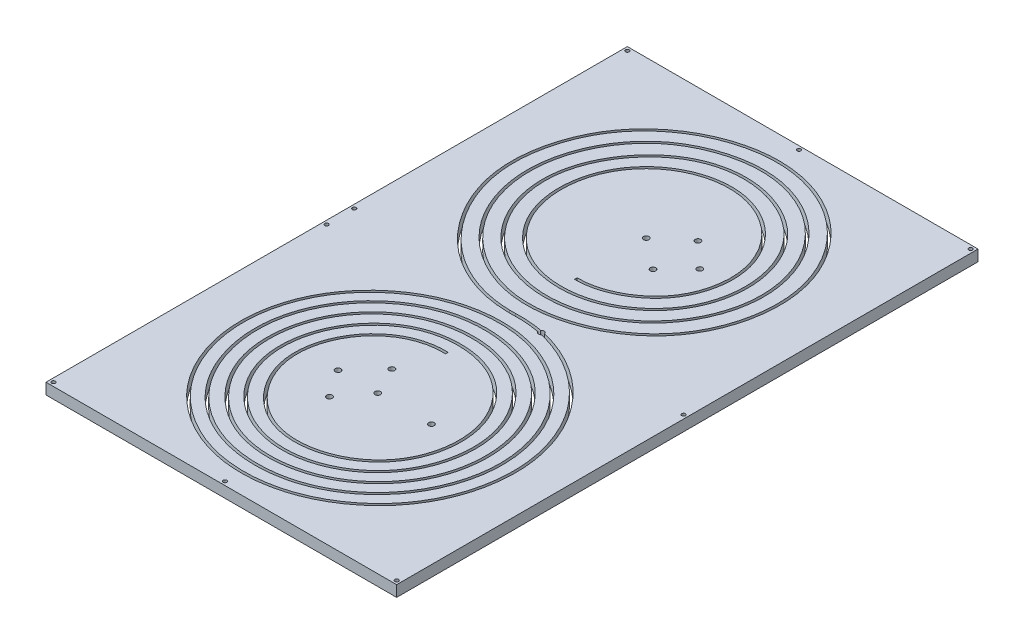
SolidWorks part; units mm, degrees
other "DetailItem1"
other "DetailItem4"
other "DetailItem5"
other "DetailItem6"
other "DetailItem7"
other "DetailItem8"
other "DetailItem9" parameters "D1"=130.8525, "D2"=69.4319, "D3"=36.4963, "D6"=12.8171, "D7"=5.2372, "D10"=14.4827, "D11"=5.361, "D14"=24.1385, "D15"=20.5722, "D17"=38.5709, "D19"=45.3058, "D22"=29.037, "D23"=48.8293, "D26"=23.3871, "D27"=9.5443, "D30"=7.2661, "D31"=33.8625, "D34"=24.3242, "D35"=7.7399, "D37"=19.4478, "D40"=16.1936, "D41"=5.7291, "D45"=13.6758, "D46"=22.4702, "D47"=36.4682, "D49"=70.9831, "D51"=12.9944, "D52"=19.8798, "D53"=33.549, "D55"=14.6272, "D58"=25.9, "D59"=4.812, "D61"=19.4793, "D66"=10.7086, "D67"=23.8166, "b3"=32, "b1"=223, "b2"=64, "D4"=32, "D5"=2.4589, "D8"=7.2455, "D9"=8.6909, "D12"=8.8045, "D13"=3.012, "D16"=2.6913, "D18"=4.7672, "D20"=1.0261, "D21"=1.3223, "D24"=8.5232, "D25"=4.2331, "D28"=9.8065, "D29"=3.1398, "D32"=14.9275, "D33"=6.4131, "D36"=5.6369, "D38"=5.0915, "D39"=2.1678, "D42"=6.9245, "D43"=3.6449, "D44"=2.0168, "D48"=2.1215, "D50"=2.0134, "D54"=10.9796, "D56"=6.0024, "D57"=3.0599, "D60"=4.877, "D62"=6.7641, "D63"=2.9135, "D64"=4.0127, "D65"=2.5645
other "DetailItem10"
other "DetailItem11"
other "DetailItem12"
other "DetailItem13"
other "DetailItem14"
other "DetailItem15"
other "DetailItem16"
other "DetailItem17"
other "DetailItem18"
other "DetailItem19"
other "DetailItem20"
other "DetailItem21"
other "DetailItem22"
other "DetailItem29"
other "DetailItem30"
other "DetailItem31"
other "DetailItem32"
other "DetailItem33"
other "DetailItem34"
ref_plane "Front Plane" through (0, 0, 0) normal (0, 0, 1) x (1, 0, 0)
ref_plane "Top Plane" through (0, 0, 0) normal (0, 1, 0) x (1, 0, 0)
ref_plane "Right Plane" through (0, 0, 0) normal (1, 0, 0) x (0, 0, -1)
sketch "Sketch1" plane through (-5.7981, 0, 1.7854) normal (0, -1, 0) x (-1, 0, 0)
  line L2 (-5.7981, 1.7854) -> (-5.7981, -70.9646) construction
  line L36 (-5.7981, 74.5354) -> (-5.7981, 1.7854) construction
  circle A0 centre (-5.7981, 1.7854) radius 55.4556
  circle A1 centre (-5.7981, 1.7854) radius 15.9155
  circle A2 centre (-5.7981, 1.7854) radius 7.9577
  circle A3 centre (17.721, 11.2854) radius 9.4498
  circle A4 centre (17.721, 11.2854) radius 11.9366
  circle A5 centre (8.8683, 26.8487) radius 5.9683
  circle A6 centre (8.8683, 26.8487) radius 31.5823
  circle A7 centre (-21.7136, 1.7854) radius 7.9577
  circle A8 centre (-21.7136, 1.7854) radius 7.9577
  circle A9 centre (-21.7136, 1.7854) radius 55.4556
  circle A10 centre (-21.7136, 1.7854) radius 46.7518
  circle A11 centre (-21.7136, 1.7854) radius 12.434
  circle A12 centre (-21.7136, 1.7854) radius 12.434
  circle A13 centre (-22.2898, 61.7144) radius 13.18
  circle A14 centre (-22.2898, 61.7144) radius 7.4604
  circle A15 centre (-5.7981, 74.5354) radius 13.4287
  circle A16 centre (-5.7981, 74.5354) radius 4.9736
  circle A17 centre (-21.1244, 87.2196) radius 14.9208
  circle A18 centre (-21.1244, 87.2196) radius 3.7302
  circle A19 centre (-34.7981, 74.5354) radius 14.9208
  circle A20 centre (8.2462, -19.337) radius 9.4498
  circle A21 centre (8.2462, -19.337) radius 13.18
  circle A22 centre (1.6995, -55.8073) radius 23.8732
  circle A23 centre (1.6995, -55.8073) radius 6.7143
  circle A24 centre (1.6995, -55.8073) radius 3.7302
  circle A25 centre (-5.7981, -70.9646) radius 13.18
  circle A26 centre (-5.7981, -70.9646) radius 14.1747
  circle A27 centre (-5.7981, -70.9646) radius 3.7302
  circle A28 centre (-34.8936, -70.9646) radius 14.9208
  circle A29 centre (5.5861, -85.7381) radius 14.9208
  circle A30 centre (5.5861, -85.7381) radius 2.9842
  circle A31 centre (15.7019, -70.9646) radius 14.9208
  circle A32 centre (-46.5815, 1.7854) radius 12.434
  circle A33 centre (-46.5815, 1.7854) radius 12.434
  point P5 (-5.7981, 74.5354)
  point P109 (-5.7981, -70.9646)
  point P110 (-5.7981, 1.7854)
  point P113 (-5.7981, 1.7854)
  point P121 (-5.7981, 1.7854)
sketch "Sketch2" plane through (0, 0, 0) normal (0, 1, 0) x (1, 0, 0)
  line L1 (-95, -157.5) -> (95, -157.5)
  line L2 (-95, -157.5) -> (-95, 157.5)
  line L3 (-95, 157.5) -> (95, 157.5)
  line L4 (95, -157.5) -> (95, 157.5)
  line L5 (-95, -157.5) -> (95, 157.5) construction
  line L6 (-95, 157.5) -> (95, -157.5) construction
  point P0 (0, 0)
  dimension "D1" = 190
  dimension "D2" = 315
extrude "Boss-Extrude1" add sketch "Sketch2" along normal blind 6
sketch "Sketch3" plane through (0, 6, 0) normal (0, 1, 0) x (1, 0, 0)
  circle A0 centre (16.4917, 59.929) radius 1.5
  circle A1 centre (0, 72.75) radius 1.5
  circle A2 centre (29, 72.75) radius 1.5
  circle A3 centre (15.3263, 85.4342) radius 1.5
  circle A4 centre (15.9155, 0) radius 1.5
  circle A5 centre (-7.4976, -57.5928) radius 1.5
  circle A6 centre (0, -72.75) radius 1.5
  circle A7 centre (-11.3842, -87.5236) radius 1.5
  circle A8 centre (29.0955, -72.75) radius 1.5
  circle A9 centre (-21.5, -72.75) radius 1.5
  dimension "D1" = 3
extrude "Cut-Extrude1" cut sketch "Sketch3" against normal blind 3
sketch "Sketch4" plane through (0, 6, 0) normal (0, 1, 0) x (1, 0, 0)
  circle A0 centre (29, 72.75) radius 1
  circle A1 centre (0, 72.75) radius 1
  circle A2 centre (29.0955, -72.75) radius 1
  circle A3 centre (0, -72.75) radius 1
  circle A4 centre (-21.5, -72.75) radius 1
  dimension "D1" = 2
extrude "Cut-Extrude2" cut sketch "Sketch4" against normal up to surface (6 mm away)
sketch "Sketch6" plane through (0, 0, 0) normal (0, -1, 0) x (1, 0, 0)
  line L0 (95, 0) -> (45, 0) construction
  line L1 (95, 157.5) -> (95, -157.5) construction
  dimension "D1" = 50
sketch "Sketch11" plane through (0, 0, 0) normal (0, -1, 0) x (1, 0, 0)
  line L0 (-0.0472, 35.9277) -> (0, 34.5284)
  line L1 (-3.2189, -0.567) -> (0, -0.5682)
  line L2 (-3.1924, -1.9668) -> (-0.0639, -1.9668)
  line L3 (-0.0786, -33.9678) -> (-0.0639, -35.3677)
  spline S0 degree 3 poles (-0.0472, 35.9277) (-26.3843, 35.0393) (-54.5138, 75.8193) (-17.7145, 119.8881) (18.4042, 116.2223) (42.3488, 95.3386) (47.6549, 61.1405) (23.6081, 28.2638) (-20.1708, 25.8961) (-47.4124, 56.028) (-49.0139, 91.6661) (-28.5696, 118.511) (6.6327, 128.3342) (46.0678, 108.686) (57.0707, 61.1559) (27.5914, 20.8216) (-20.3887, 18.7755) (-53.7302, 49.5731) (-58.8017, 96.9801) (-21.8064, 134.8067) (27.2495, 130.621) (57.6471, 99.1696) (61.2763, 57.9681) (36.6797, 17.9839) (-14.2244, 8.5545) (-51.6711, 34.8924) (-67.2899, 74.6536) (-54.4177, 115.5679) (-18.6657, 139.6909) (20.8962, 139.4889) (55.2797, 115.6583) (71.2652, 75.013) (57.3312, 30.334) (18.1392, 4.0234) (-29.4608, 7.8342) (-63.3458, 38.2026) (-73.8078, 81.6255) (-57.0665, 124.5185) (-17.1507, 148.0964) (28.4463, 144.8489) (66.7416, 115.4774) (78.5744, 64.7703) (55.4344, 14.7028) (19.3497, -1.4528) (0, -0.5682) knots 0 0 0 0 0.038756 0.062283 0.081165 0.094776 0.114611 0.134338 0.15794 0.179285 0.19725 0.215055 0.233017 0.256011 0.28268 0.305599 0.333133 0.353706 0.378511 0.406641 0.432317 0.454523 0.476455 0.498556 0.529469 0.552959 0.571797 0.599779 0.61869 0.642796 0.662765 0.687486 0.712525 0.737225 0.762841 0.788881 0.809926 0.836111 0.862282 0.883886 0.911336 0.939243 0.966677 1 1 1 1
  spline S1 degree 1 poles (0, 34.5284) (-0.0639, -1.9668) knots 0 0 1 1 construction
  spline S2 degree 3 number of poles 132 (0, 34.5284) -> (-0.0639, -1.9668)
  spline S3 degree 3 poles (-0.0639, -35.3677) (7.0376, -35.2931) (20.0882, -39.1326) (38.7081, -54.9013) (45.0484, -83.0944) (29.653, -110.0915) (2.6895, -121.5085) (-24.5324, -114.5931) (-46.2489, -91.8934) (-48.164, -55.1454) (-20.8459, -26.3438) (18.331, -25.5895) (47.0174, -50.4333) (52.0646, -84.2576) (37.4015, -116.6882) (4.3103, -130.3709) (-34.9464, -120.6069) (-59.6216, -84.454) (-50.4919, -46.2153) (-28.2418, -23.0863) (4.231, -15.2962) (33.5875, -26.8504) (52.7657, -48.7768) (61.2673, -77.2405) (51.8371, -108.5553) (29.9323, -129.3344) (2.4817, -137.4432) (-22.2955, -132.6519) (-44.6404, -119.624) (-59.9501, -97.7337) (-65.0702, -68.3577) (-56.7541, -41.4596) (-37.8411, -20.5296) (-13.5195, -9.4171) (19.9246, -10.5615) (52.026, -28.7239) (66.8815, -62.242) (66.8233, -94.7879) (51.9539, -122.0708) (28.4341, -138.8639) (2.9028, -145.3073) (-28.4181, -140.6709) (-56.0459, -121.3428) (-70.1816, -91.946) (-73.7552, -54.5751) (-49.3782, -13.6312) (-17.5395, -2.2385) (-3.1924, -1.9668) knots 0 0 0 0 0.015233 0.028566 0.051135 0.070949 0.091045 0.109845 0.128088 0.155693 0.179891 0.205855 0.232357 0.254401 0.275227 0.305051 0.322435 0.360207 0.384208 0.401935 0.427288 0.451298 0.466095 0.489187 0.512075 0.533043 0.551877 0.571733 0.58573 0.606987 0.627016 0.648275 0.665249 0.68679 0.703507 0.736292 0.759834 0.779492 0.804856 0.82347 0.840553 0.86043 0.890315 0.908845 0.929441 0.96948 1 1 1 1
  spline S4 degree 1 poles (-0.0786, -33.9678) (-3.2189, -0.567) knots 0 0 1 1 construction
  spline S5 degree 3 number of poles 113 (-0.0786, -33.9678) -> (-3.2189, -0.567)
  dimension "D1" = 1.4
  dimension "D2" = 1.4
extrude "Cut-Extrude3" cut sketch "Sketch11" against normal up to surface (6 mm away)
sketch "Sketch13" plane through (0, 6, 0) normal (0, 1, 0) x (1, 0, 0)
  line L10 (-93, 7.5) -> (-93, -7.5) construction
  line L14 (-93, -155.5) -> (93, -155.5)
  line L15 (93, -155.5) -> (93, 155.5)
  line L16 (93, 155.5) -> (-93, 155.5)
  line L17 (-93, 155.5) -> (-93, -155.5)
  line L18 (-93, -155.5) -> (93, -155.5) construction
  line L19 (93, -155.5) -> (93, 155.5) construction
  line L20 (93, 155.5) -> (-93, 155.5) construction
  line L21 (-93, 155.5) -> (-93, -155.5) construction
  circle A0 centre (-93, 7.5) radius 1
  circle A1 centre (-93, -7.5) radius 1
  circle A2 centre (-93, 155.5) radius 1
  circle A3 centre (93, 155.5) radius 1
  circle A4 centre (0, 155.5) radius 1
  circle A5 centre (93, 0) radius 1
  circle A6 centre (0, -155.5) radius 1
  circle A7 centre (93, -155.5) radius 1
  circle A8 centre (-93, -155.5) radius 1
  point P8 (-93, 0)
  dimension "D3" = 2
  dimension "D2" = 15
  dimension "D1" = 2
extrude "Cut-Extrude4" cut sketch "Sketch13" against normal blind 2
equation "\"b3\"=32"
equation "\"b2\"=64"
equation "\"b1\"=223"
equation "\"D1@Sketch1\"  = \"b1\" / pi * \"scale\""
equation "\"D2@Sketch1\"  = \"b2\" / pi * \"scale\""
equation "\"D3@Sketch1\"  = \"b3\" / pi * \"scale\""
equation "\"c1\"=38"
equation "\"c2\"=48"
equation "\"D6@Sketch1\"  = \"c1\" / pi * \"scale\""
equation "\"D7@Sketch1\"  = \"c2\" / pi * \"scale\""
equation "\"d2\"=127"
equation "\"d1\"= 24"
equation "\"D10@Sketch1\"  = \"d2\" / pi * \"scale\""
equation "\"D11@Sketch1\"  = \"d1\" / pi * \"scale\""
equation "\"e1\"=32"
equation "\"e2\"=32"
equation "\"D14@Sketch1\"  = \"e2\" / pi * \"scale\""
equation "\"D15@Sketch1\"  = \"e1\" / pi * \"scale\""
equation "\"e3\"=223"
equation "\"D17@Sketch1\"  = \"e3\" / pi * \"scale\""
equation "\"e4\"=188"
equation "\"D19@Sketch1\"  = \"e4\" / pi * \"scale\""
equation "\"e5\"=50"
equation "\"D22@Sketch1\"  = \"e5\" / pi * \"scale\""
equation "\"e6\"=50"
equation "\"D23@Sketch1\"  = \"e6\" / pi * \"scale\""
equation "\"f2\"=30"
equation "\"f1\"=53"
equation "\"D26@Sketch1\"  = \"f1\" / pi * \"scale\""
equation "\"D27@Sketch1\"  = \"f2\" / pi * \"scale\""
equation "\"g2\"=20"
equation "\"g1\"=54"
equation "\"D30@Sketch1\"  = \"g2\" / pi * \"scale\""
equation "\"D31@Sketch1\"  = \"g1\" / pi * \"scale\""
equation "\"h1\"=60"
equation "\"h2\"=15"
equation "\"D34@Sketch1\"  = \"h1\" / pi * \"scale\""
equation "\"D35@Sketch1\"  = \"h2\" / pi * \"scale\""
equation "\"i1\"=60"
equation "\"D37@Sketch1\"  = \"i1\" / pi * \"scale\""
equation "\"l1\"=38"
equation "\"l2\"=53"
equation "\"D41@Sketch1\"  = \"l2\" / pi * \"scale\""
equation "\"D40@Sketch1\"  = \"l1\" / pi * \"scale\""
equation "\"m1\"=96"
equation "\"m2\"=15"
equation "\"m3\"=27"
equation "\"D45@Sketch1\"  = \"m3\" / pi * \"scale\""
equation "\"D46@Sketch1\"  = \"m2\" / pi * \"scale\""
equation "\"D47@Sketch1\"  = \"m1\" / pi * \"scale\""
equation "\"n3\"=15"
equation "\"n2\"=57"
equation "\"n1\"=53"
equation "\"D51@Sketch1\"  = \"n1\" / pi * \"scale\""
equation "\"D52@Sketch1\"  = \"n2\" / pi * \"scale\""
equation "\"D53@Sketch1\"  = \"n3\" / pi * \"scale\""
equation "\"o1\"=60"
equation "\"D55@Sketch1\"  = \"o1\" / pi * \"scale\""
equation "\"p1\"=60"
equation "\"p2\"=12"
equation "\"D58@Sketch1\"  = \"p1\" / pi * \"scale\""
equation "\"D59@Sketch1\"  = \"p2\" / pi * \"scale\""
equation "\"q1\"= 60"
equation "\"D61@Sketch1\"  = \"q1\" / pi * \"scale\""
equation "\"scale\"= 1.5625'scaling factor"
equation "\"k1\"=50"
equation "\"k2\"=50"
equation "\"D66@Sketch1\"=\"k2\"/pi*\"scale\""
equation "\"D67@Sketch1\"=\"k1\"/pi*\"scale\""
